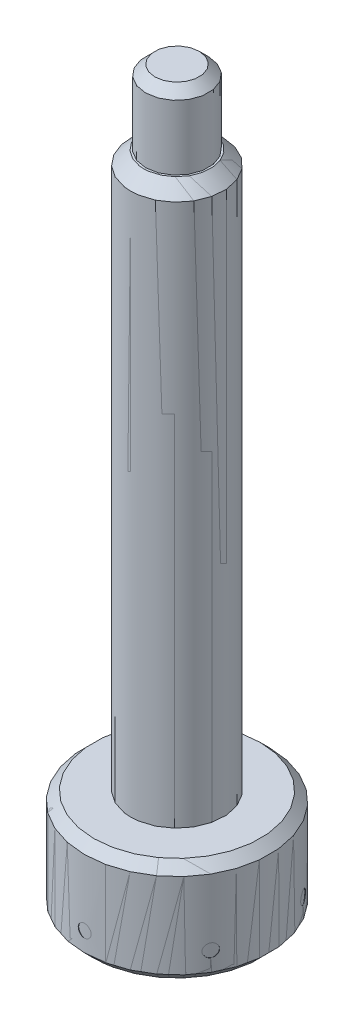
SolidWorks part; units mm, degrees
ref_plane "Front Plane" through (0, 0, 0) normal (0, 0, 1) x (1, 0, 0)
ref_plane "Top Plane" through (0, 0, 0) normal (0, 1, 0) x (1, 0, 0)
ref_plane "Right Plane" through (0, 0, 0) normal (1, 0, 0) x (0, 0, -1)
sketch "Sketch1" plane through (0, 0, 0) normal (0, 1, 0) x (1, 0, 0)
  circle A0 centre (0, 0) radius 6.35
  dimension "D1" = 12.7
extrude "Extrude1" add sketch "Sketch1" along normal blind 4.572
sketch "Sketch4" plane through (0, 0, 0) normal (0, -1, 0) x (1, 0, 0)
  circle A1 centre (0, 0) radius 6.35
  circle A2 centre (0, 0) radius 6.35
  dimension "D1" = 0
extrude "Extrude4" add sketch "Sketch4" along normal blind 1.27
sketch "Sketch5" plane through (0, 4.572, 0) normal (0, 1, 0) x (1, 0, 0)
  circle A1 centre (0, 0) radius 6.35
  circle A2 centre (0, 0) radius 6.35
  dimension "D1" = 0
extrude "Extrude5" add sketch "Sketch5" along normal blind 1.27
sketch "Sketch2" plane through (0, 5.842, 0) normal (0, 1, 0) x (1, 0, 0)
  circle A0 centre (0, 0) radius 3.175
  dimension "D1" = 6.35
extrude "Extrude2" add sketch "Sketch2" along normal blind 38.1
sketch "Sketch3" plane through (0, 43.942, 0) normal (0, 1, 0) x (1, 0, 0)
  circle A0 centre (0, 0) radius 2.159
  dimension "D1" = 4.318
extrude "Extrude3" add sketch "Sketch3" along normal blind 5.08
chamfer "Chamfer1" distance 0.635 angle 45 2 edges at (0, -1.27, -6.35) (0, 5.842, 6.35)
chamfer "Chamfer2" distance 0.889 angle 45 1 edges at (0, 43.942, 3.175)
chamfer "Chamfer3" distance 0.635 angle 45 1 edges at (0, 49.022, 2.159)
ref_point "Point1"
sketch "Sketch6" plane through (0, 0, 0) normal (0, 0, 1) x (1, 0, 0)
  line L0 (0, -0.635) -> (-0.635, -1.27)
  line L1 (-6.35, -0.635) -> (6.35, -0.635) construction
  line L2 (-5.715, -1.27) -> (5.715, -1.27) construction
  line L3 (0, -0.635) -> (0.635, -1.27)
  line L4 (-0.635, -1.27) -> (0.635, -1.27)
extrude "Extrude7" [suppressed] cut sketch "Sketch6" against normal through all and the other way through all
sketch "Sketch7" plane through (0, 0, 0) normal (0, 0, 1) x (1, 0, 0)
  circle A0 centre (0, 0.6799) radius 0.4445
  dimension "D1" = 0.889
extrude "Extrude8" [suppressed] cut sketch "Sketch7" against normal through all and the other way through all
pattern_circular "CirPattern1" [suppressed] count 3 over 360
